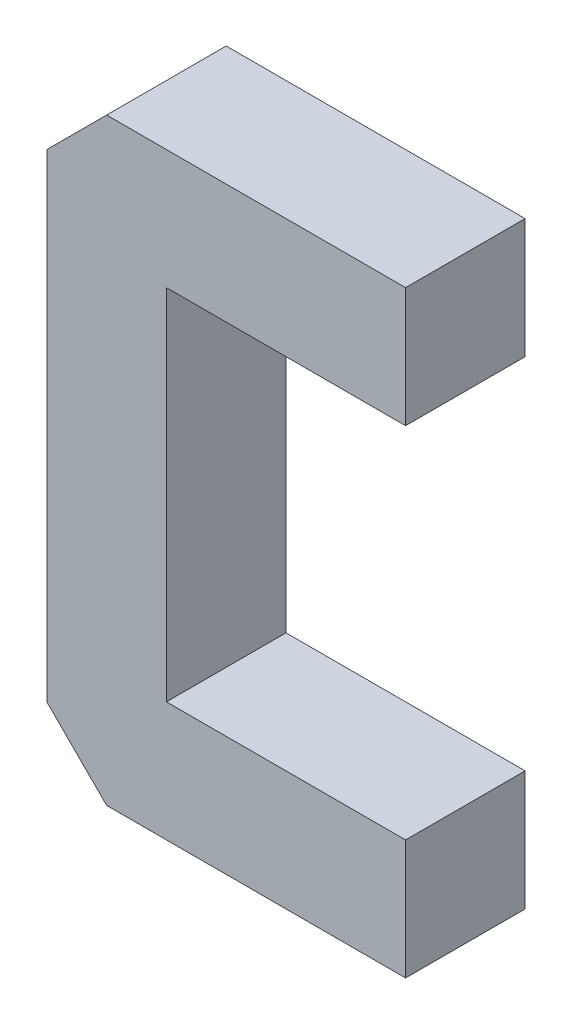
SolidWorks part; units mm, degrees
ref_plane "Plan de face" through (0, 0, 0) normal (0, 0, 1) x (1, 0, 0)
ref_plane "Plan de dessus" through (0, 0, 0) normal (0, 1, 0) x (1, 0, 0)
ref_plane "Plan de droite" through (0, 0, 0) normal (1, 0, 0) x (0, 0, -1)
sketch "Esquisse1" plane through (0, 0, 0) normal (0, 0, 1) x (1, 0, 0)
  line L0 (30, 40) -> (30, 50)
  line L1 (0, 0) -> (30, 0)
  line L2 (0, 0) -> (0, 50)
  line L3 (0, 50) -> (30, 50)
  line L4 (30, 0) -> (30, 10)
  line L5 (30, 40) -> (10, 40)
  line L7 (30, 10) -> (10, 10)
  line L8 (10, 40) -> (10, 10)
  dimension "D1" = 30
  dimension "D2" = 50
  dimension "D3" = 30
  dimension "D4" = 10
  dimension "D6" = 10
extrude "Boss.-Extru.1" add sketch "Esquisse1" along normal blind 10
chamfer "Chanfrein1" distance 5 angle 45 2 edges at (0, 0, 5) (0, 50, 5)
